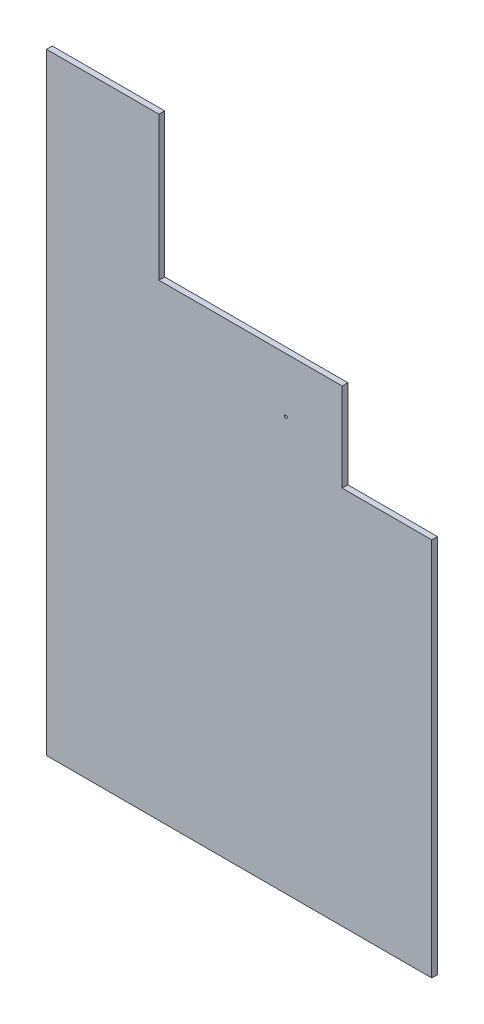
SolidWorks part; units mm, degrees
ref_plane "Plan de face" through (0, 0, 0) normal (0, 0, 1) x (1, 0, 0)
ref_plane "Plan de dessus" through (0, 0, 0) normal (0, 1, 0) x (1, 0, 0)
ref_plane "Plan de droite" through (0, 0, 0) normal (1, 0, 0) x (0, 0, -1)
sketch "Esquisse1" plane through (0, 0, 0) normal (0, 0, 1) x (1, 0, 0)
  line L0 (0, 0) -> (-675, 0)
  line L1 (-675, 0) -> (-675, 1072)
  line L2 (-675, 1072) -> (-478, 1072)
  line L3 (-478, 1072) -> (-478, 820)
  line L4 (-478, 820) -> (-157, 820)
  line L5 (-157, 820) -> (-157, 665)
  line L6 (-157, 665) -> (0, 665)
  line L7 (0, 665) -> (0, 0)
  circle A0 centre (-255.5, 724) radius 2.5
  dimension "D7" = 5
  dimension "D1" = 675
  dimension "D2" = 665
  dimension "D3" = 197
  dimension "D4" = 321
  dimension "D5" = 252
  dimension "D6" = 1072
  dimension "D8" = 98.5
  dimension "D9" = 96
extrude "Extrusion1" add sketch "Esquisse1" along normal blind 10
